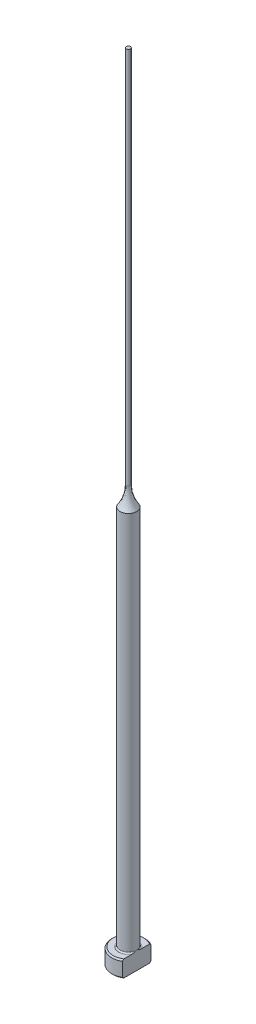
SolidWorks part; units mm, degrees
ref_plane "Front Plane" through (0, 0, 0) normal (0, 0, 1) x (1, 0, 0)
ref_plane "Top Plane" through (0, 0, 0) normal (0, 1, 0) x (1, 0, 0)
ref_plane "Right Plane" through (0, 0, 0) normal (1, 0, 0) x (0, 0, -1)
sketch "Sketch1" plane through (0, 0, 0) normal (0, 0, 1) x (1, 0, 0)
  line L0 (0, 259.9588) -> (0, -15.1925) construction
  line L1 (0, 0) -> (-3.175, 0)
  line L2 (-3.175, 0) -> (-3.175, 3.175)
  line L3 (-3.175, 3.175) -> (-1.5875, 3.175)
  line L4 (-0.3962, 79.9027) -> (-0.3962, 152.4)
  line L5 (-0.3962, 152.4) -> (0, 152.4)
  line L6 (0, 152.4) -> (0, 0)
  line L7 (-1.5875, 3.175) -> (-1.5875, 76.2)
  arc A0 (-1.5875, 76.2) -> (-0.3962, 79.9027) centre (-6.7462, 79.9027) ccw
  point P13 (-1.5875, 0)
  dimension "D1" = 6.35
  dimension "L" = 152.4
  dimension "D2" = 3.175
  dimension "H" = 6.35
  dimension "T" = 3.175
  dimension "D" = 0.7925
  dimension "S" = 76.2
revolve "Revolve1" add sketch "Sketch1" angle 360 about L0
chamfer "Chamfer1" distance 0.254 angle 45 2 edges at (0, 3.175, 3.175) (0, 0, 3.175)
fillet "Fillet1" radius 0.254 1 edges at (0, 3.175, 1.5875)
sketch "Sketch2" plane through (0, 0, 0) normal (0, 1, 0) x (1, 0, 0)
  line L0 (1.5875, -2.7496) -> (1.5875, 2.7496)
  circle A0 centre (0, 0) radius 3.175 construction
  arc A2 (1.5875, -2.7496) -> (1.5875, 2.7496) centre (0, 0) ccw
  circle A3 centre (0, 0) radius 3.175 construction
  circle A4 centre (0, 0) radius 1.5875 construction
extrude "Key Head" cut sketch "Sketch2" along normal up to next
